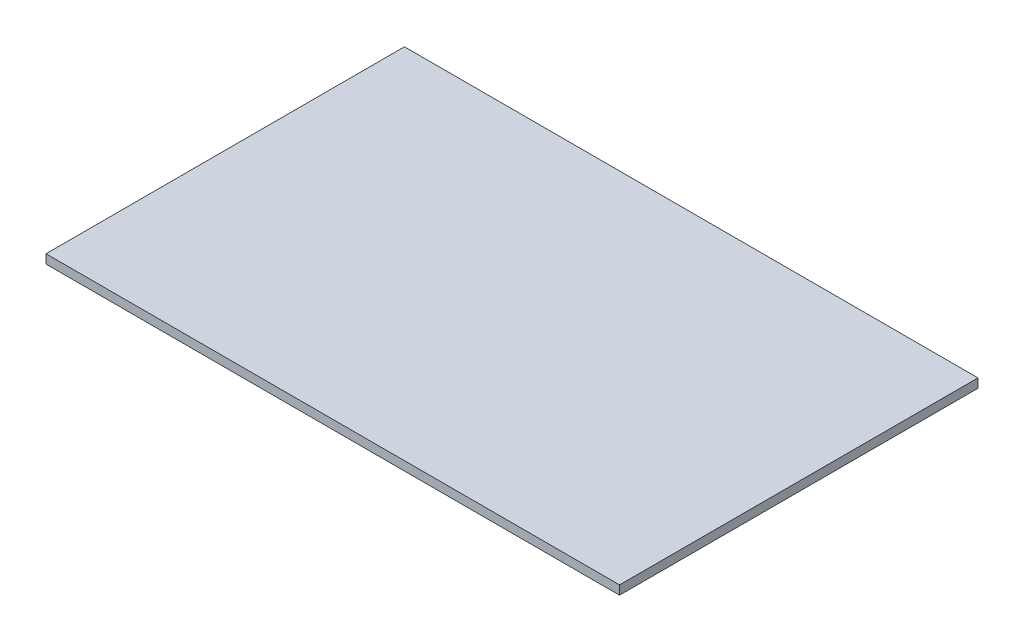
SolidWorks part; units mm, degrees
ref_plane "Front Plane" through (0, 0, 0) normal (0, 0, 1) x (1, 0, 0)
ref_plane "Top Plane" through (0, 0, 0) normal (0, 1, 0) x (1, 0, 0)
ref_plane "Right Plane" through (0, 0, 0) normal (1, 0, 0) x (0, 0, -1)
sketch "Sketch1" plane through (0, 0, 0) normal (0, 1, 0) x (1, 0, 0)
  line L1 (0, 0) -> (406.4, 0)
  line L2 (0, 0) -> (0, 254)
  line L3 (0, 254) -> (406.4, 254)
  line L4 (406.4, 0) -> (406.4, 254)
  dimension "D1" = 254
  dimension "D2" = 406.4
extrude "Extrude1" add sketch "Sketch1" along normal blind 6.35
